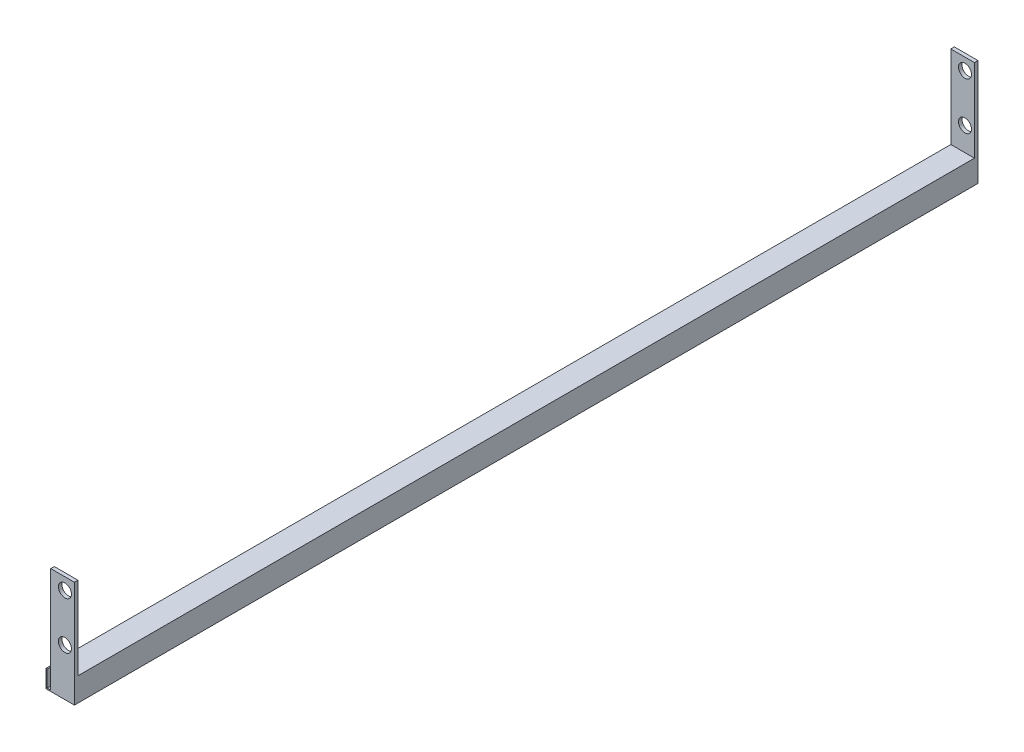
SolidWorks part; units mm, degrees
ref_plane "Plan de face" through (0, 0, 0) normal (0, 0, 1) x (1, 0, 0)
ref_plane "Plan de dessus" through (0, 0, 0) normal (0, 1, 0) x (1, 0, 0)
ref_plane "Plan de droite" through (0, 0, 0) normal (1, 0, 0) x (0, 0, -1)
sketch "Esquisse1" plane through (0, 0, 0) normal (0, 0, 1) x (1, 0, 0)
  line L0 (1, 1) -> (1, 19)
  line L1 (0, 0) -> (20, 0)
  line L2 (0, 0) -> (0, 20)
  line L3 (0, 20) -> (20, 20)
  line L4 (20, 0) -> (20, 20)
  line L5 (1, 19) -> (19, 19)
  line L6 (19, 1) -> (19, 19)
  line L7 (1, 1) -> (19, 1)
  dimension "D1" = 20
  dimension "D2" = 20
  dimension "D3" = 1
extrude "Extrusion1" add sketch "Esquisse1" along normal blind 758
sketch "Esquisse2" plane through (0, 0, 758) normal (0, 0, 1) x (1, 0, 0)
  line L1 (20, 0) -> (0, 0)
  line L2 (20, 0) -> (20, 90)
  line L3 (20, 90) -> (0, 90)
  line L4 (0, 0) -> (0, 90)
  circle A0 centre (12, 80) radius 5.5
  circle A1 centre (12, 40) radius 5.5
  dimension "D2" = 11
  dimension "D5" = 11
  dimension "D1" = 90
  dimension "D3" = 10
  dimension "D4" = 8
  dimension "D6" = 40
  dimension "D7" = 20
extrude "Extrusion2" add sketch "Esquisse2" along normal blind 3
sketch "Esquisse4" plane through (0, 0, 0) normal (0, 0, -1) x (-1, 0, 0)
  line L4 (-20, 90) -> (-20, 0)
  line L5 (0, 90) -> (-20, 90)
  line L6 (0, 0) -> (0, 90)
  line L7 (-20, 0) -> (0, 0)
  line L8 (-20, 90) -> (-20, 0)
  line L9 (0, 90) -> (-20, 90)
  line L10 (0, 0) -> (0, 90)
  line L11 (-20, 0) -> (0, 0)
  circle A0 centre (-12, 40) radius 5.5 construction
  circle A1 centre (-12, 40) radius 5.5
  circle A2 centre (-12, 80) radius 5.5 construction
  circle A3 centre (-12, 80) radius 5.5
  dimension "D1" = 0
extrude "Extrusion3" add sketch "Esquisse4" along normal blind 3
sketch "Esquisse5" plane through (0, 0, -3) normal (0, 0, -1) x (-1, 0, 0)
  line L0 (0, 0) -> (4, 0)
  line L1 (4, 0) -> (4, 15)
  line L2 (0, 1) -> (3, 1)
  line L3 (3, 1) -> (3, 15)
  line L4 (3, 15) -> (4, 15)
  line L5 (0, 1) -> (0, 0)
  dimension "D1" = 4
  dimension "D2" = 15
  dimension "D3" = 1
extrude "Extrusion4" add sketch "Esquisse5" against normal up to surface (764 mm away)
sketch "Esquisse6" plane through (0, 0, 0) normal (0, -1, 0) x (1, 0, 0)
  circle A0 centre (6.8, 663.5) radius 5.5
  circle A1 centre (6.8, 93.5) radius 5.5
extrude "Enlèv. mat.-Extru.1" cut sketch "Esquisse6" against normal blind 30
sketch "Esquisse7" plane through (0, 0, -3) normal (0, 0, -1) x (-1, 0, 0)
  line L0 (0, 0) -> (0, 90) construction
  line L1 (-20, 90) -> (0, 90)
  line L2 (-20, 90) -> (-20, 55.1358)
  line L3 (-20, 55.1358) -> (0, 55.1358)
  line L4 (0, 90) -> (0, 55.1358)
extrude "Enlèv. mat.-Extru.2" cut sketch "Esquisse7" against normal up to surface (774 mm away)
